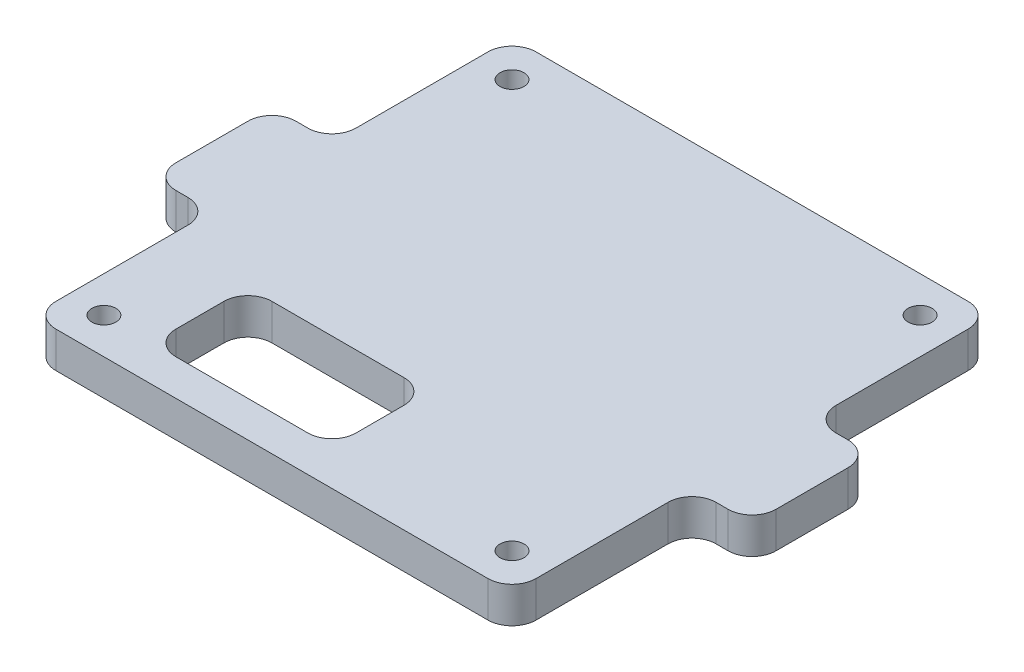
SolidWorks part; units mm, degrees
ref_plane "Front Plane" through (0, 0, 0) normal (0, 0, 1) x (1, 0, 0)
ref_plane "Top Plane" through (0, 0, 0) normal (0, 1, 0) x (1, 0, 0)
ref_plane "Right Plane" through (0, 0, 0) normal (1, 0, 0) x (0, 0, -1)
sketch "Sketch1" plane through (0, 0, 0) normal (0, 1, 0) x (1, 0, 0)
  line L0 (0, 20) -> (0, -20) construction
  line L1 (20, -20) -> (-20, -20)
  line L2 (20, -20) -> (20, -5)
  line L3 (20, 20) -> (-20, 20)
  line L4 (-20, -20) -> (-20, -5)
  line L5 (20, -20) -> (-20, 20) construction
  line L6 (20, 20) -> (-20, -20) construction
  line L7 (20, 0) -> (-20, 0) construction
  line L8 (-20, 5) -> (-20, 20)
  line L9 (-13, -17) -> (2, -17)
  line L10 (-13, -17) -> (-13, -9)
  line L11 (-13, -9) -> (2, -9)
  line L12 (2, -17) -> (2, -9)
  line L13 (25, -5) -> (20, -5)
  line L14 (25, -5) -> (25, 5)
  line L15 (25, 5) -> (20, 5)
  line L16 (-25, -5) -> (-25, 5)
  line L17 (25, -5) -> (-25, 5) construction
  line L18 (25, 5) -> (-25, -5) construction
  line L19 (-20, 5) -> (-25, 5)
  line L21 (-25, -5) -> (-20, -5)
  line L22 (20, 5) -> (20, 20)
  circle A0 centre (-17, 17) radius 1
  circle A1 centre (17, 17) radius 1
  circle A2 centre (-17, -17) radius 1
  circle A3 centre (17, -17) radius 1
  point P0 (0, 0)
  point P22 (0, 0)
  dimension "D3" = 2
  dimension "D1" = 40
  dimension "D2" = 40
  dimension "D4" = 3
  dimension "D5" = 3
  dimension "D6" = 7
  dimension "D7" = 15
  dimension "D8" = 8
  dimension "D9" = 50
  dimension "D10" = 10
extrude "Boss-Extrude1" add sketch "Sketch1" along normal blind 3
fillet "Fillet1" radius 2 16 edges at (2, 1.5, 17) (2, 1.5, 9) (-13, 1.5, 9) (-13, 1.5, 17) (-20, 1.5, -20) (20, 1.5, -5) (25, 1.5, -5) (25, 1.5, 5) (20, 1.5, 5) (20, 1.5, 20) (-20, 1.5, 20) (-20, 1.5, 5) (-25, 1.5, 5) (-25, 1.5, -5) (-20, 1.5, -5) (20, 1.5, -20)
